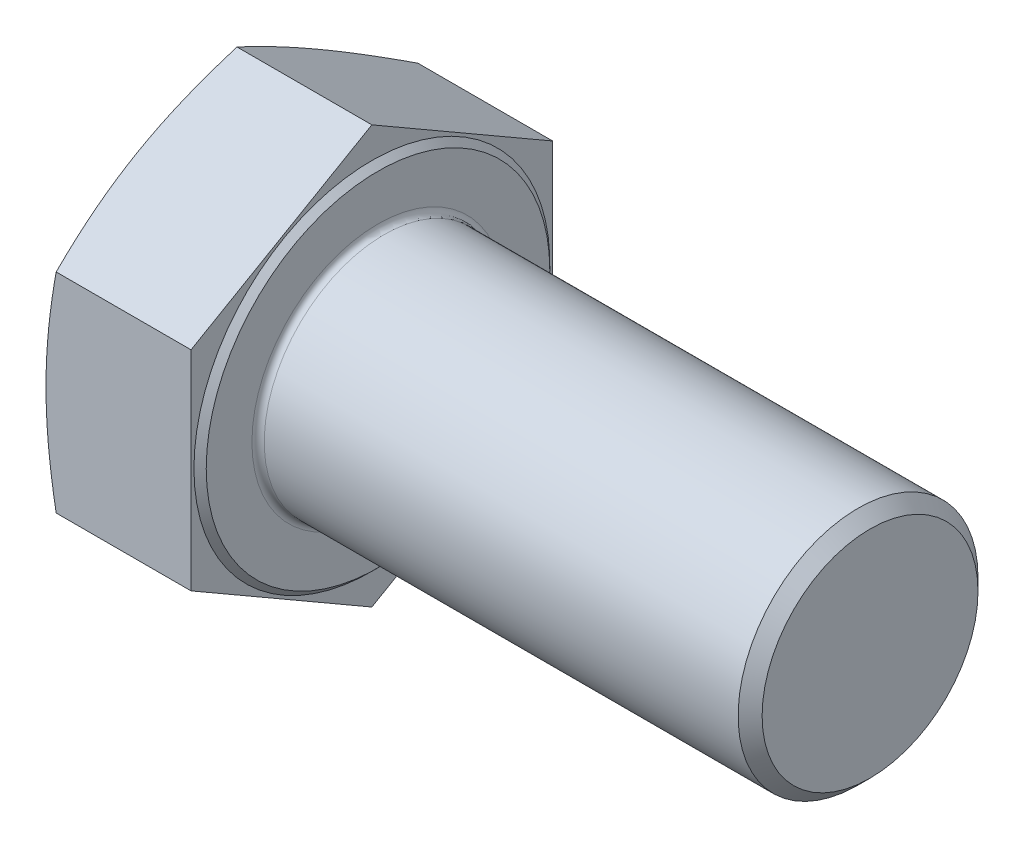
SolidWorks part; units mm, degrees
ref_plane "Front" through (0, 0, 0) normal (0, 0, 1) x (1, 0, 0)
ref_plane "Top" through (0, 0, 0) normal (0, 1, 0) x (1, 0, 0)
ref_plane "Right" through (0, 0, 0) normal (1, 0, 0) x (0, 0, -1)
sketch "Sketch2" plane through (0, 0, 0) normal (1, 0, 0) x (0, 0, -1)
  line L1 (29.4, -16.9741) -> (29.4, 16.9741)
  line L2 (29.4, 16.9741) -> (0, 33.9482)
  line L3 (0, 33.9482) -> (-29.4, 16.9741)
  line L4 (-29.4, 16.9741) -> (-29.4, -16.9741)
  line L5 (-29.4, -16.9741) -> (0, -33.9482)
  line L6 (0, -33.9482) -> (29.4, -16.9741)
  circle A0 centre (0, 0) radius 29.4 construction
  dimension "s" = 58.8
extrude "BaseHead" add sketch "Sketch2" along normal blind 24.58
sketch "Sketch3" plane through (0, 0, 0) normal (0, 0, 1) x (1, 0, 0)
  line L0 (24.58, 33.9482) -> (24.58, 27.93)
  line L2 (24.58, 27.93) -> (23.58, 28.93)
  line L3 (23.58, 28.93) -> (23.58, 33.9482)
  line L5 (23.58, 33.9482) -> (24.58, 33.9482)
  line L6 (-0.9571, 0) -> (7.6478, 0) construction
  line L7 (24.58, 33.9482) -> (0, 33.9482) construction
  dimension "D1" = 45
  dimension "c" = 1
  dimension "dw" = 55.86
revolve "BearingFace" cut sketch "Sketch3" angle 360 about L6
sketch "Sketch4" plane through (0, 0, 0) normal (0, 0, 1) x (1, 0, 0)
  line L0 (-0.4935, 0) -> (3.5626, 0) construction
  line L2 (0, 33.9482) -> (1.6554, 33.9482)
  line L4 (1.6554, 33.9482) -> (0, 29.4)
  line L6 (0, 29.4) -> (0, 33.9482)
  line L7 (23.58, 33.9482) -> (0, 33.9482) construction
  dimension "D1" = 20
  dimension "D2" = 58.8
revolve "HeadChamfer" cut sketch "Sketch4" angle 360 about L0
sketch "Sketch5" plane through (24.58, 0, 0) normal (1, 0, 0) x (0, 0, -1)
  circle A0 centre (0, 0) radius 19.5
  dimension "d" = 39
extrude "BaseBody" add sketch "Sketch5" along normal blind 80
chamfer "Chamfer1" distance 1.95 angle 45 1 edges at (104.58, 0, -19.5)
fillet "HeadFillet" radius 1 1 edges at (24.58, 0, -19.5)
equation "\"D2@Sketch4\" = \"s@Sketch2\""
equation "\"D1@Chamfer1\" = 0.05 * \"d@Sketch5\""
